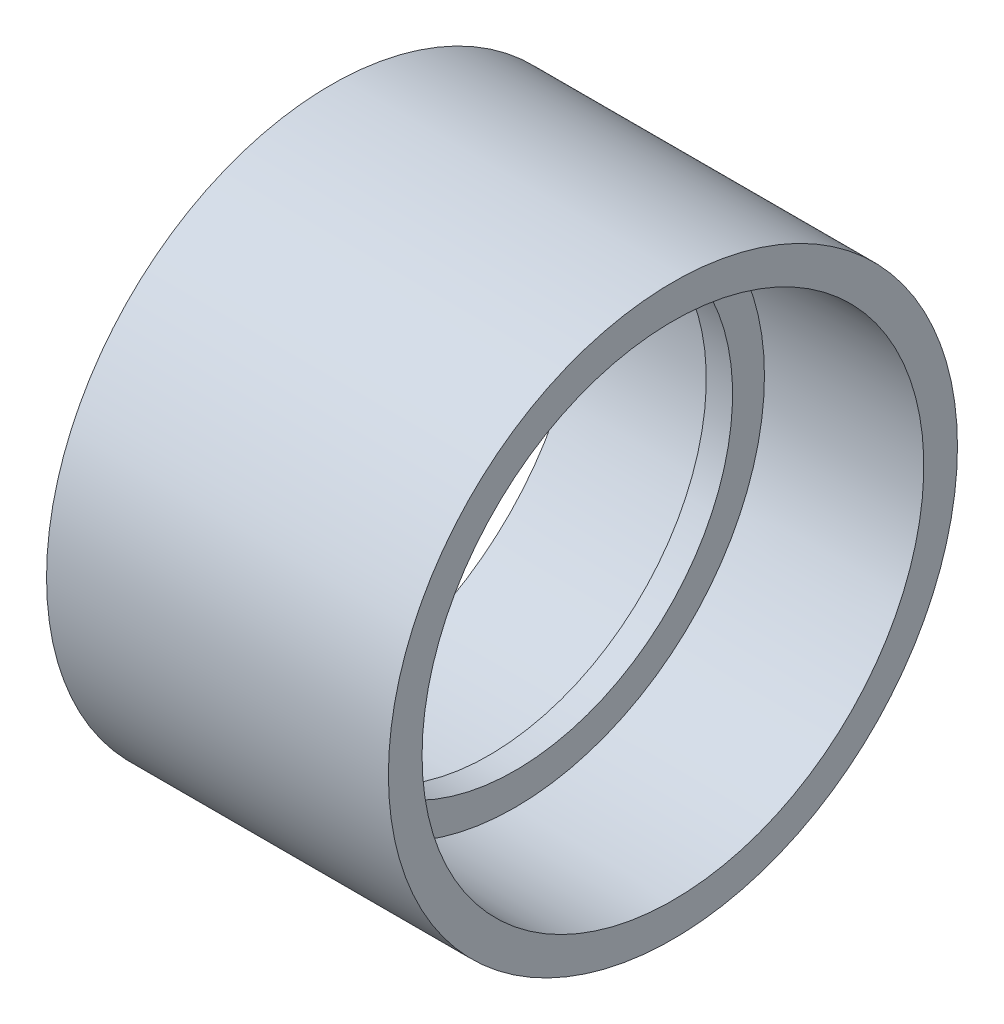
SolidWorks part; units mm, degrees
ref_plane "Front Plane" through (0, 0, 0) normal (0, 0, 1) x (1, 0, 0)
ref_plane "Top Plane" through (0, 0, 0) normal (0, 1, 0) x (1, 0, 0)
ref_plane "Right Plane" through (0, 0, 0) normal (1, 0, 0) x (0, 0, -1)
sketch "Sketch0" plane through (0, 0, 0) normal (0, 0, 1) x (1, 0, 0)
  line L0 (-20.6375, 0) -> (0, 0) construction
  line L1 (0, 0) -> (0, 34.3535) construction
  line L2 (-1.5875, 0) -> (0, 0) construction
  line L4 (-20.6375, 34.3535) -> (-20.6375, -34.3535) construction
  line L5 (-1.5875, 30.099) -> (-20.6375, 30.2895) construction
  line L6 (-1.5875, 30.099) -> (-1.5875, -30.099) construction
  line L7 (-1.5875, -30.099) -> (-20.6375, -30.2895) construction
  line L8 (-20.6375, 30.2895) -> (-20.6375, -30.2895) construction
  line L14 (-1.5875, 26.2509) -> (-1.5875, -26.2509) construction
  line L15 (-1.5875, -26.2509) -> (-1.5875, -30.3149) construction
  line L16 (-20.6375, -30.2895) -> (-20.6375, -34.3535) construction
  line L21 (-20.6375, 0) -> (-1.5875, 0) construction
  dimension "A" = 3.175
  dimension "OD A" = 60.579
  dimension "OD B" = 60.198
  dimension "ID" = 52.5018
  dimension "H" = 4.064
  dimension "C" = 19.05
sketch "Sketch1" plane through (0, 0, 0) normal (0, 0, 1) x (1, 0, 0)
  line L0 (-20.6375, 0) -> (0, 0) construction
  line L1 (-20.6375, 0) -> (0, 0) construction
  line L2 (-20.6375, -34.3535) -> (20.6375, -34.3535)
  line L3 (0, 0) -> (0, -34.3535) construction
  line L4 (-20.6375, -34.3535) -> (-20.6375, -30.2895)
  line L5 (-20.6375, -30.2895) -> (-1.5875, -30.099)
  line L6 (-1.5875, -34.3535) -> (-1.5875, -30.099) construction
  line L7 (1.5875, -26.2509) -> (1.5875, -30.099)
  line L8 (-1.5875, -26.2509) -> (-1.5875, -30.099)
  line L9 (20.6375, -30.2895) -> (1.5875, -30.099)
  line L10 (20.6375, -34.3535) -> (20.6375, -30.2895)
  line L11 (-1.5875, -26.2509) -> (1.5875, -26.2509)
revolve "Revolve1" add sketch "Sketch1" angle 360 about L1
sketch "Sketch2" plane through (-1.5875, 0, 0) normal (-1, 0, 0) x (0, 0, 1)
  circle A0 centre (0, 0) radius 30.099 construction
  circle A1 centre (0, 0) radius 30.099
extrude "Cut-Extrude1" [suppressed] cut sketch "Sketch2" against normal up to surface (3.175 mm away)
